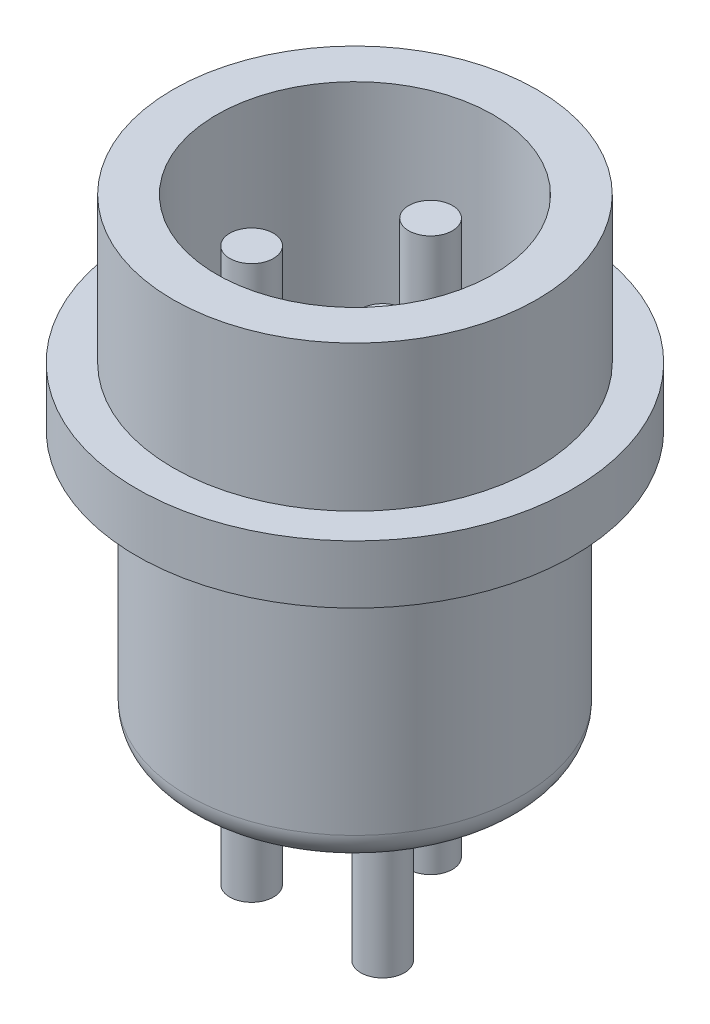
SolidWorks part; units mm, degrees
ref_plane "Plan de face" through (0, 0, 0) normal (0, 0, 1) x (1, 0, 0)
ref_plane "Plan de dessus" through (0, 0, 0) normal (0, 1, 0) x (1, 0, 0)
ref_plane "Plan de droite" through (0, 0, 0) normal (1, 0, 0) x (0, 0, -1)
sketch "Esquisse1" plane through (0, 0, 0) normal (0, 0, 1) x (1, 0, 0)
  line L0 (0, 0) -> (0, 9.5905) construction
  line L1 (0, 0) -> (4.75, 0)
  line L2 (4.75, 0) -> (4.75, 10)
  line L3 (4.75, 10) -> (6.25, 10)
  line L4 (6.25, 10) -> (6.25, 5)
  line L5 (6.25, 5) -> (7.5, 5)
  line L6 (7.5, 5) -> (7.5, 3)
  line L7 (7.5, 3) -> (5.75, 3)
  line L8 (5.75, 3) -> (5.75, -6)
  line L9 (5.75, -6) -> (0, -6)
  line L10 (0, -6) -> (0, 0)
  dimension "D1" = 9.5
  dimension "D2" = 10
  dimension "D3" = 5
  dimension "D4" = 2
  dimension "D5" = 9
  dimension "D6" = 12.5
  dimension "D7" = 15
  dimension "D8" = 11.5
revolve "Révolution1" add sketch "Esquisse1" angle 360 about L0
sketch "Esquisse2" plane through (0, 0, 0) normal (0, 1, 0) x (1, 0, 0)
  line L0 (0, 2.5981) -> (-2.25, -1.299) construction
  line L1 (-2.25, -1.299) -> (2.25, -1.299) construction
  line L2 (2.25, -1.299) -> (0, 2.5981) construction
  line L3 (0, 2.5981) -> (0, -1.299) construction
  line L5 (1.125, 0.6495) -> (-2.25, -1.299) construction
  circle A0 centre (0, 2.5981) radius 0.75
  circle A1 centre (-2.25, -1.299) radius 0.75
  circle A2 centre (2.25, -1.299) radius 0.75
  dimension "D2" = 1.5
  dimension "D1" = 4.5
extrude "Boss.-Extru.1" add sketch "Esquisse2" along normal blind 8 and the other way blind 11
fillet "Congé1" radius 1 1 edges at (0, -6, -5.75)
